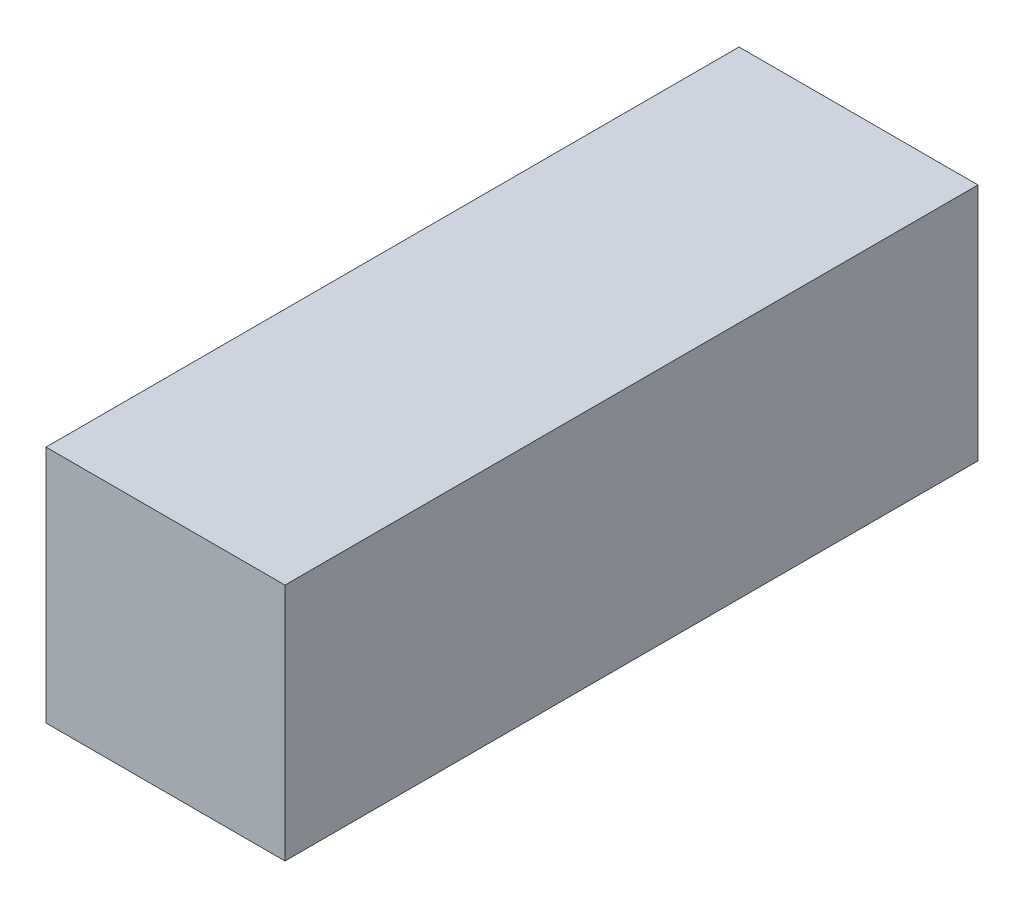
SolidWorks part; units mm, degrees
ref_plane "前视基准面" through (0, 0, 0) normal (0, 0, 1) x (1, 0, 0)
ref_plane "上视基准面" through (0, 0, 0) normal (0, 1, 0) x (1, 0, 0)
ref_plane "右视基准面" through (0, 0, 0) normal (1, 0, 0) x (0, 0, -1)
other "Configuration Table"
sketch "草图1" plane through (0, 0, 0) normal (0, 0, 1) x (1, 0, 0)
  line L1 (0, 0) -> (20, 0)
  line L2 (0, 0) -> (0, 20)
  line L3 (0, 20) -> (20, 20)
  line L4 (20, 0) -> (20, 20)
extrude "V2_REF_gripper_body" add sketch "草图1" along normal blind 58
